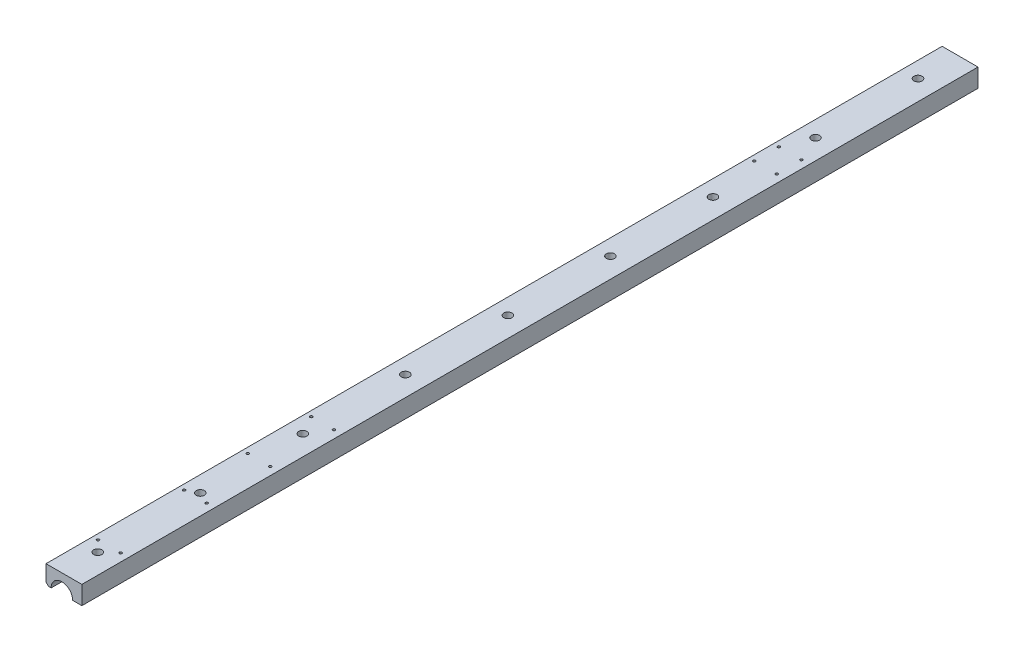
SolidWorks part; units mm, degrees
ref_plane "Face" through (0, 0, 0) normal (0, 0, 1) x (1, 0, 0)
ref_plane "Dessus" through (0, 0, 0) normal (0, 1, 0) x (1, 0, 0)
ref_plane "Droite" through (0, 0, 0) normal (1, 0, 0) x (0, 0, -1)
sketch "Esquisse1" plane through (0, 0, 0) normal (0, 0, 1) x (1, 0, 0)
  line L0 (0, 5) -> (5, 0)
  line L1 (5, 0) -> (10, 0)
  line L2 (0, 5) -> (0, 36)
  line L3 (0, 36) -> (70, 36)
  line L4 (70, 0) -> (70, 36)
  line L5 (52, 0) -> (70, 0)
  arc A0 (52, 0) -> (10, 0) centre (31, 0) ccw
  point P0 (0, 0)
  dimension "D3" = 42
  dimension "D1" = 36
  dimension "D2" = 70
  dimension "D5" = 5
  dimension "D4" = 36
  dimension "D6" = 39
extrude "Extrusion1" add sketch "Esquisse1" along normal blind 1748
hole_wizard "Trou taraudé M61" positions "Esquisse3" profile "Esquisse2" tap size "M6" standard "ISO"
sketch "Esquisse3" plane through (0, 36, 0) normal (0, 1, 0) x (-1, 0, 0)
  point P1 (-54.5, 329)
  point P4 (-54.5, 377)
  point P7 (-10.5, 329)
  point P10 (-10.5, 377)
  point P13 (-54.5, 1241)
  point P16 (-10.5, 1241)
  point P19 (-54.5, 1365)
  point P22 (-10.5, 1365)
  point P25 (-54.5, 1489)
  point P28 (-10.5, 1489)
  point P31 (-54.5, 1657)
  point P34 (-10.5, 1657)
sketch "Esquisse2" plane through (54.5, 36, 329) normal (1, 0, 0) x (0, 0, 1)
  line L0 (0, 0) -> (0, 22.5022)
  line L1 (0, 22.5022) -> (2.5, 21)
  line L2 (2.5, 21) -> (2.5, 0)
  line L5 (2.5, 0) -> (0, 0)
  line L10 (0, 22.5022) -> (-2.5, 21) construction
  line L11 (0, -6.35) -> (0, 107.95) construction
  dimension "Diamètre du trou pour taraudage" = 5
  dimension "Profondeur du trou pour taraudage" = 21
  dimension "Angle de pointe" = 118
sketch "Esquisse4" plane through (0, 36, 0) normal (0, 1, 0) x (1, 0, 0)
  line L0 (0, -1748) -> (0, 0) construction
  circle A0 centre (31, -1678) radius 8
  dimension "D1" = 16
  dimension "D2" = 31
  dimension "D3" = 70
extrude "Enlèv. mat.-Extru.1" cut sketch "Esquisse4" against normal through all
pattern_linear "Répétition linéaire1" count 9 spacing 200 along (0, 0, -1) of "Enlèv. mat.-Extru.1"
